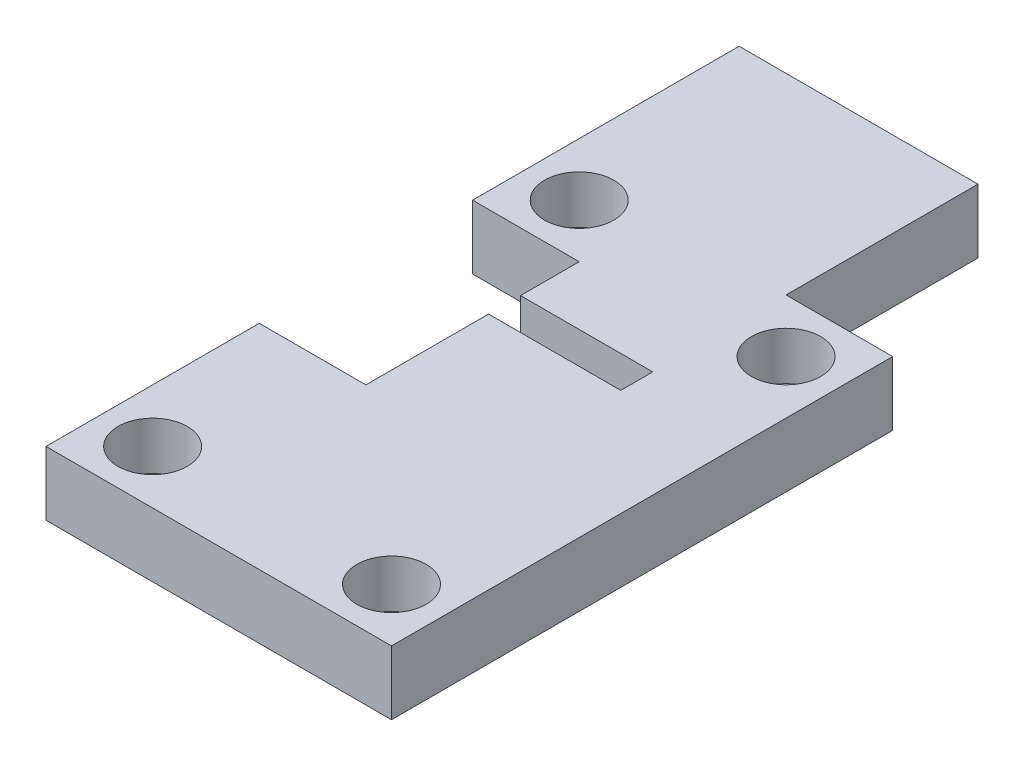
SolidWorks part; units mm, degrees
ref_plane "前视基准面" through (0, 0, 0) normal (0, 0, 1) x (1, 0, 0)
ref_plane "上视基准面" through (0, 0, 0) normal (0, 1, 0) x (1, 0, 0)
ref_plane "右视基准面" through (0, 0, 0) normal (1, 0, 0) x (0, 0, -1)
sketch "草图1" plane through (0, 0, 0) normal (0, 0, 1) x (1, 0, 0)
  line L0 (0, 0) -> (32.4, 0)
  line L1 (0, 6) -> (32.4, 6)
  line L2 (32.4, 0) -> (32.4, 6)
  line L3 (0, 0) -> (0, 6)
extrude "凸台-拉伸1" add sketch "草图1" along normal blind 65
sketch "草图2" plane through (0, 6, 0) normal (0, 1, 0) x (1, 0, 0)
  line L0 (0, -65) -> (32.4, -65)
  line L1 (22.4, -18) -> (32.4, -18)
  line L2 (32.4, -65) -> (32.4, -18)
  line L3 (0, -65) -> (0, -45)
  line L4 (0, -45) -> (10, -45)
  line L5 (0, -25) -> (10, -25)
  line L6 (10, -45) -> (10, -33.5)
  line L7 (0, -25) -> (0, 0)
  line L8 (10, -30.5) -> (22.4, -30.5)
  line L9 (10, -33.5) -> (22.4, -33.5)
  line L10 (22.4, -33.5) -> (22.4, -30.5)
  line L11 (10, -30.5) -> (10, -25)
  line L12 (0, 0) -> (22.4, 0)
  line L13 (22.4, 0) -> (22.4, -18)
  circle A0 centre (27.4, -23) radius 1.75
  circle A1 centre (27.4, -60) radius 1.75
  circle A2 centre (5, -60) radius 1.75
  circle A3 centre (5, -20) radius 1.75
extrude "切除-拉伸1" cut sketch "草图2" against normal blind 65 flip side to cut
sketch "草图3" plane through (0, 6, 0) normal (0, 1, 0) x (1, 0, 0)
  circle A0 centre (27.4, -23) radius 3.25
  circle A1 centre (27.4, -60) radius 3.25
  circle A2 centre (5, -60) radius 3.25
  circle A3 centre (5, -20) radius 3.25
extrude "切除-拉伸2" cut sketch "草图3" against normal blind 4.5
